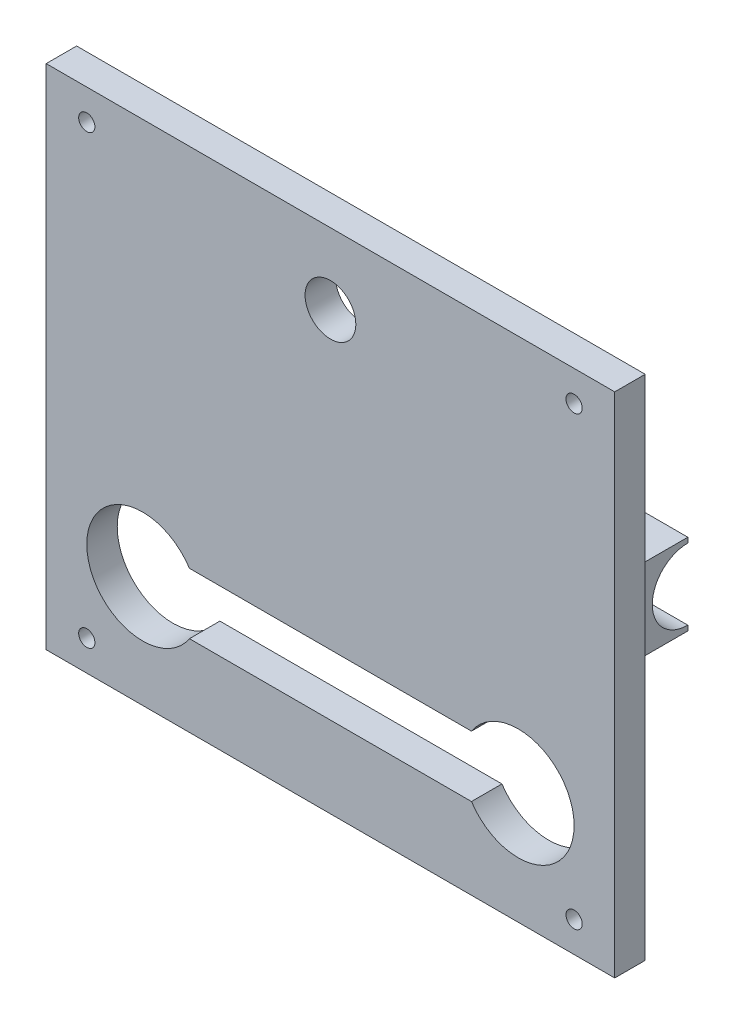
SolidWorks part; units mm, degrees
ref_plane "Plan de face" through (0, 0, 0) normal (0, 0, 1) x (1, 0, 0)
ref_plane "Plan de dessus" through (0, 0, 0) normal (0, 1, 0) x (1, 0, 0)
ref_plane "Plan de droite" through (0, 0, 0) normal (1, 0, 0) x (0, 0, -1)
sketch "Esquisse1" plane through (0, 0, 0) normal (0, 0, 1) x (1, 0, 0)
  line L1 (0, 0) -> (280, 0)
  line L2 (0, 0) -> (0, -250)
  line L3 (0, -250) -> (280, -250)
  line L4 (280, 0) -> (280, -250)
  dimension "D1" = 280
  dimension "D2" = 250
extrude "Boss.-Extru.1" add sketch "Esquisse1" along normal blind 15
sketch "Esquisse2" plane through (0, 0, 15) normal (0, 0, 1) x (1, 0, 0)
  line L0 (0, 0) -> (0, -250) construction
  line L1 (70.5489, -180) -> (209.4511, -180)
  line L2 (75, -195) -> (205, -195) construction
  line L3 (0, -250) -> (280, -250) construction
  line L4 (70.5489, -210) -> (209.4511, -210) construction
  line L5 (70.5489, -180) -> (209.4511, -180) construction
  line L6 (70.5489, -210) -> (209.4511, -210)
  line L7 (75, -180) -> (205, -180) construction
  line L8 (75, -210) -> (205, -210) construction
  circle A0 centre (47.5, -195) radius 17.5 construction
  circle A1 centre (232.5, -195) radius 17.5 construction
  arc A2 (70.5489, -180) -> (70.5489, -210) centre (47.5, -195) ccw
  arc A3 (209.4511, -210) -> (209.4511, -180) centre (232.5, -195) ccw
  circle A5 centre (47.5, -195) radius 27.5 construction
  circle A6 centre (232.5, -195) radius 27.5 construction
  point P10 (258.7984, -156.9598)
  point P18 (73.7984, -156.9598)
  point P21 (140, -180)
  point P24 (140, -210)
  dimension "D2" = 35
  dimension "D1" = 185
  dimension "D3" = 47.5
  dimension "D4" = 55
  dimension "D6" = 15
  dimension "D5" = 10
  dimension "D7" = 15
extrude "Enlèv. mat.-Extru.1" cut sketch "Esquisse2" against normal blind 15
sketch "Esquisse3" plane through (0, 0, 0) normal (0, 0, -1) x (-1, 0, 0)
  line L0 (-280, 0) -> (0, 0) construction
  line L1 (-255, -145) -> (-25, -145)
  line L2 (-255, -145) -> (-255, -105)
  line L3 (-255, -105) -> (-25, -105)
  line L4 (-25, -145) -> (-25, -105)
  line L6 (0, 0) -> (0, -250) construction
  line L7 (-280, -250) -> (-280, 0) construction
  point P4 (-255, -125)
  dimension "D1" = 40
  dimension "D2" = 125
  dimension "D3" = 25
  dimension "D4" = 25
extrude "Boss.-Extru.2" add sketch "Esquisse3" along normal blind 46
sketch "Esquisse4" plane through (0, 0, 15) normal (0, 0, 1) x (1, 0, 0)
  line L1 (280, -250) -> (280, 0) construction
  line L2 (280, 0) -> (0, 0) construction
  circle A0 centre (140, -35) radius 12.5
  dimension "D2" = 25
  dimension "D1" = 140
  dimension "D3" = 35
extrude "Enlèv. mat.-Extru.2" cut sketch "Esquisse4" against normal blind 15
sketch "Esquisse5" plane through (0, 0, 15) normal (0, 0, 1) x (1, 0, 0)
  line L0 (0, -250) -> (280, -250) construction
  line L1 (0, 0) -> (0, -250) construction
  line L2 (280, -250) -> (280, 0) construction
  line L3 (280, 0) -> (0, 0) construction
  circle A0 centre (20, -235) radius 4
  circle A1 centre (260, -235) radius 4
  circle A2 centre (20, -15) radius 4
  circle A3 centre (260, -15) radius 4
  dimension "D1" = 8
  dimension "D2" = 15
  dimension "D3" = 20
  dimension "D4" = 20
  dimension "D5" = 15
  dimension "D6" = 15
extrude "Enlèv. mat.-Extru.3" cut sketch "Esquisse5" against normal blind 15
sketch "Esquisse6" plane through (255, 0, 0) normal (1, 0, 0) x (0, 0, -1)
  line L0 (46, -105) -> (46, -145) construction
  line L1 (46, -142.5) -> (46, -107.5)
  arc A0 (46, -142.5) -> (46, -107.5) centre (46, -125) cw
  dimension "D1" = 17.5
extrude "Enlèv. mat.-Extru.4" cut sketch "Esquisse6" against normal through all
